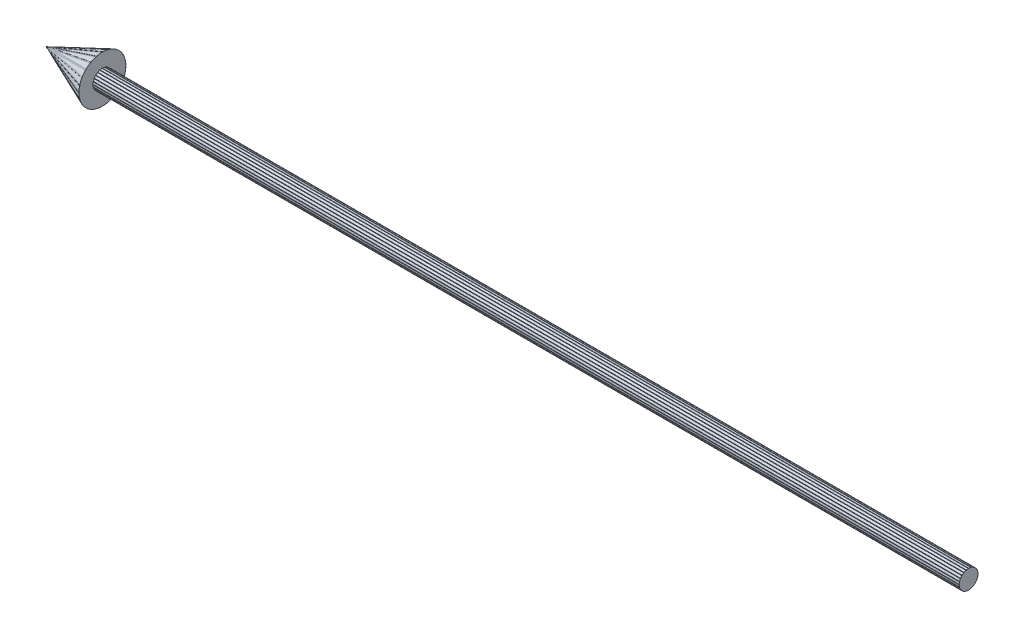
SolidWorks part; units mm, degrees
ref_plane "Face" through (0, 0, 0) normal (0, 0, 1) x (1, 0, 0)
ref_plane "Dessus" through (0, 0, 0) normal (0, 1, 0) x (1, 0, 0)
ref_plane "Droite" through (0, 0, 0) normal (1, 0, 0) x (0, 0, -1)
sketch "Esquisse1" plane through (0, 0, 0) normal (1, 0, 0) x (0, 0, -1)
  circle A0 centre (0, 0) radius 1
  dimension "D1" = 2
extrude "Boss.-Extru.1" add sketch "Esquisse1" along normal blind 92.2
sketch "Esquisse2" plane through (0, 0, 0) normal (0, 0, 1) x (1, 0, 0)
  line L0 (0, 0) -> (-11.2925, 0) construction
  line L1 (0, 0) -> (0, 2.5)
  line L2 (0, 2.5) -> (-6, 0)
  line L3 (-6, 0) -> (0, 0)
  dimension "D1" = 6
  dimension "D2" = 5
revolve "Révolution1" add sketch "Esquisse2" angle 360 about L0
sketch "Esquisse3" plane through (92.2, 0, 0) normal (1, 0, 0) x (0, 0, -1)
  line L0 (0, 0.98) -> (-0.05, 1.03)
  line L1 (-0.05, 1.03) -> (0.05, 1.03)
  line L2 (0.05, 1.03) -> (0, 0.98)
  line L3 (0, 0) -> (0, 0.98) construction
  dimension "D1" = 0.1
  dimension "D2" = 0.98
  dimension "D3" = 90
extrude "Enlèv. mat.-Extru.1" cut sketch "Esquisse3" against normal up to surface (92.2 mm away)
pattern_circular "Répétition circulaire1" count 24 over 360 about axis through (0, 0, 0) along (1, 0, 0) of "Enlèv. mat.-Extru.1"
sketch "Esquisse4" plane through (0, 0, 0) normal (0, 0, 1) x (1, 0, 0)
  line L0 (0, 2.4783) -> (-5.7805, 0.0698)
  line L1 (-5.7805, 0.0698) -> (-5.8325, 0.0698)
  line L2 (0, 2.5) -> (-6, 0) construction
  line L3 (-5.8325, 0.0698) -> (0, 2.5)
  line L4 (0, 2.5) -> (0, 2.4783)
  line L8 (0, 0.0198) -> (-6.1417, 0.0198) construction
  dimension "D1" = 0.02
  dimension "D2" = 0.05
extrude "Enlèv. mat.-Extru.2" cut sketch "Esquisse4" against normal mid plane 0.1
pattern_circular "Répétition circulaire2" count 24 over 360 about axis through (0, 0, 0) along (1, 0, 0) of "Enlèv. mat.-Extru.2"
ref_point "Point1"
